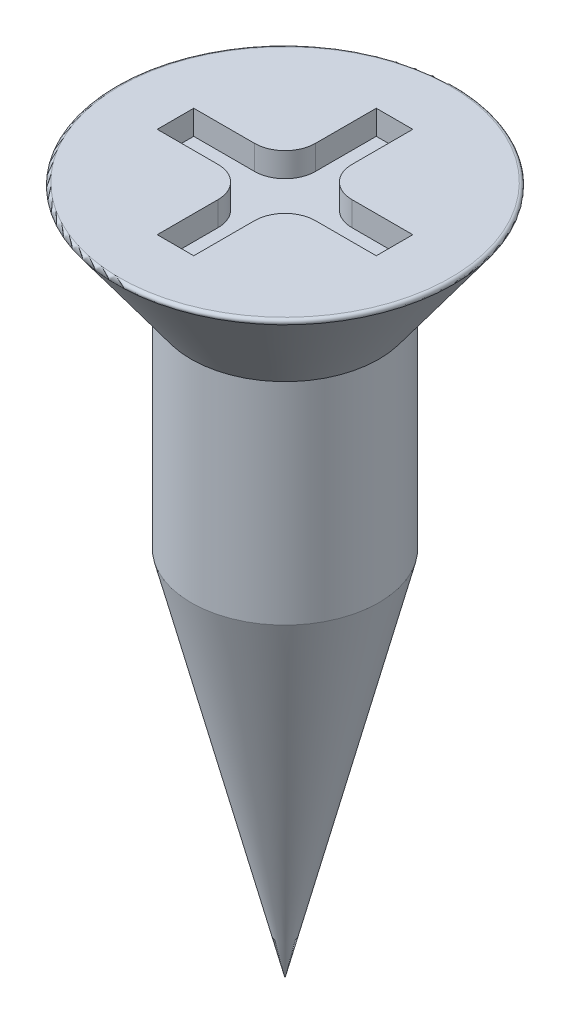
SolidWorks part; units mm, degrees
ref_plane "Front Plane" through (0, 0, 0) normal (0, 0, 1) x (1, 0, 0)
ref_plane "Top Plane" through (0, 0, 0) normal (0, 1, 0) x (1, 0, 0)
ref_plane "Right Plane" through (0, 0, 0) normal (1, 0, 0) x (0, 0, -1)
sketch "Sketch1" plane through (0, 0, 0) normal (0, 0, 1) x (1, 0, 0)
  line L0 (-1.543, 9.5781) -> (-2.8217, 11.3296)
  line L1 (0, 10.3838) -> (-0.6826, 11.3296)
  line L2 (-1.543, 6.1136) -> (0, 0)
  line L3 (-1.543, 9.5781) -> (-1.543, 6.1136)
  line L4 (0, 10.3838) -> (0, 0)
  line L5 (-0.6826, 11.3296) -> (-2.8217, 11.3296)
revolve "Revolve1" add sketch "Sketch1" angle 360 about L4
sketch "Sketch2" plane through (0, 11.3296, 0) normal (0, 1, 0) x (1, 0, 0)
  circle A0 centre (0, 0) radius 0.6826
extrude "Boss-Extrude1" add sketch "Sketch2" against normal blind 1
sketch "Sketch3" plane through (0, 11.3296, 0) normal (0, 1, 0) x (1, 0, 0)
  line L0 (0, 2.8217) -> (0, 0) construction
  line L1 (0, 0) -> (-2.8217, 0) construction
  line L2 (-0.3, 1.8) -> (-0.3, 0.3)
  line L3 (-0.3, 0.3) -> (-1.8, 0.3)
  line L4 (0.3, 1.8) -> (0.3, 0.3)
  line L5 (0.3, 0.3) -> (1.8, 0.3)
  line L6 (0.3, -0.3) -> (1.8, -0.3)
  line L7 (0.3, -1.8) -> (0.3, -0.3)
  line L8 (-0.3, -1.8) -> (-0.3, -0.3)
  line L9 (-0.3, -0.3) -> (-1.8, -0.3)
  line L10 (-1.8, 0.3) -> (-1.8, -0.3)
  line L11 (-0.3, -1.8) -> (0.3, -1.8)
  line L12 (1.8, -0.3) -> (1.8, 0.3)
  line L13 (-0.3, 1.8) -> (0.3, 1.8)
  circle A0 centre (0, 0) radius 2.8217 construction
  dimension "D1" = 0.6
  dimension "D2" = 0.3
  dimension "D3" = 1.5
  dimension "D4" = 1.5
extrude "Cut-Extrude1" cut sketch "Sketch3" against normal blind 0.4
fillet "Fillet1" radius 0.05 1 edges at (-2.8217, 11.3296, 0)
fillet "Fillet2" radius 0.5 4 edges at (0.3, 11.1296, 0.3) (0.3, 11.1296, -0.3) (-0.3, 11.1296, 0.3) (-0.3, 11.1296, -0.3)
